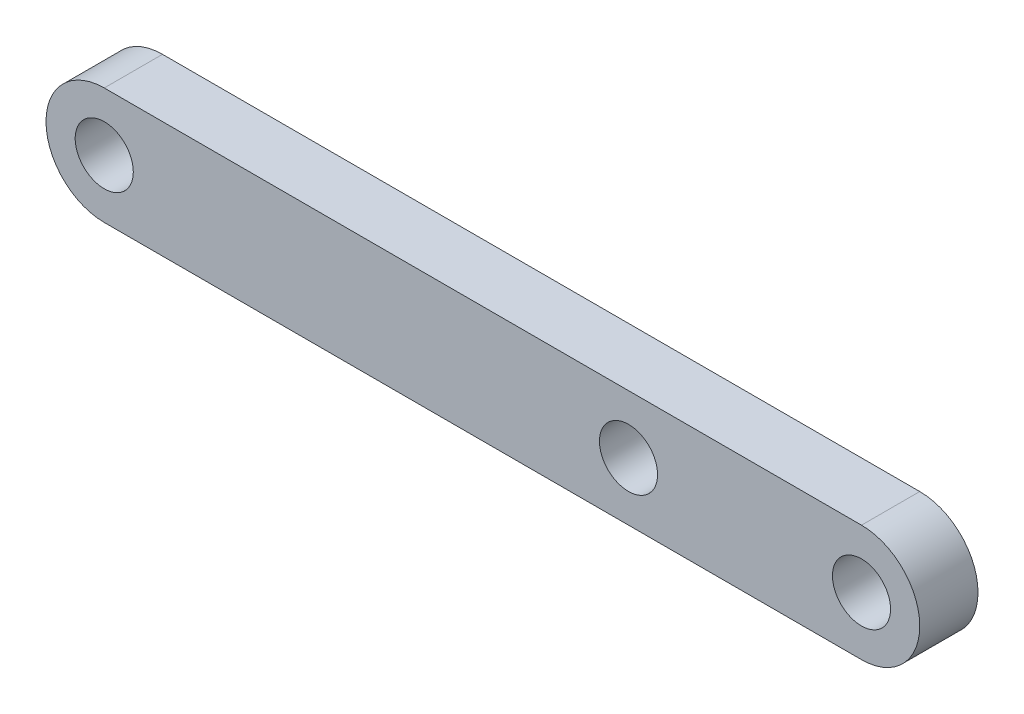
SolidWorks part; units mm, degrees
ref_plane "Front Plane" through (0, 0, 0) normal (0, 0, 1) x (1, 0, 0)
ref_plane "Top Plane" through (0, 0, 0) normal (0, 1, 0) x (1, 0, 0)
ref_plane "Right Plane" through (0, 0, 0) normal (1, 0, 0) x (0, 0, -1)
sketch "Sketch2" plane through (0, 0, 0) normal (0, 0, 1) x (1, 0, 0)
  line L0 (-20.6375, 0) -> (20.6375, 0) construction
  line L1 (-20.6375, 3.175) -> (20.6375, 3.175)
  line L2 (-20.6375, -3.175) -> (20.6375, -3.175)
  arc A0 (-20.6375, 3.175) -> (-20.6375, -3.175) centre (-20.6375, 0) ccw
  arc A1 (20.6375, -3.175) -> (20.6375, 3.175) centre (20.6375, 0) ccw
  circle A2 centre (-20.6375, 0) radius 1.5842
  circle A3 centre (7.9375, 0) radius 1.5842
  circle A4 centre (20.6375, 0) radius 1.5842
  point P2 (0, 0)
  dimension "D3" = 3.1684
  dimension "D4" = 3.1684
  dimension "D6" = 3.1684
  dimension "D1" = 28.575
  dimension "D2" = 6.35
  dimension "D5" = 12.7
extrude "Boss-Extrude1" add sketch "Sketch2" against normal blind 3.175
